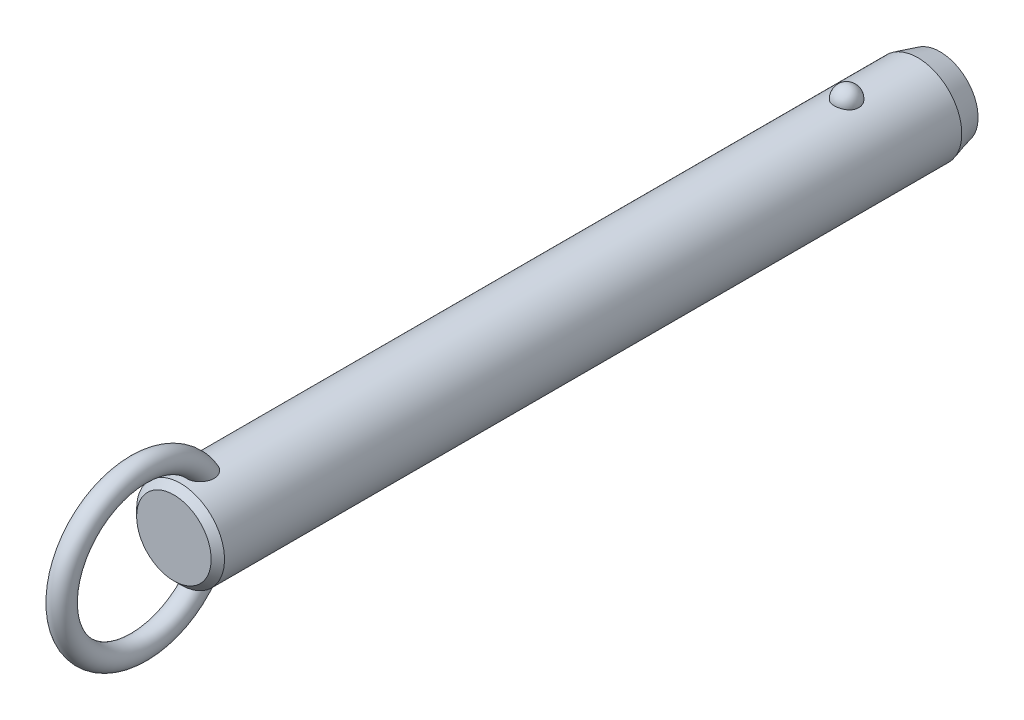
SolidWorks part; units mm, degrees
ref_plane "Front Plane" through (0, 0, 0) normal (0, 0, 1) x (1, 0, 0)
ref_plane "Top Plane" through (0, 0, 0) normal (0, 1, 0) x (1, 0, 0)
ref_plane "Right Plane" through (0, 0, 0) normal (1, 0, 0) x (0, 0, -1)
sketch "Sketch2" plane through (0, 0, 0) normal (0, 0, 1) x (1, 0, 0)
  circle A0 centre (0, 0) radius 7.9
  point P3 (0, 7.9)
  dimension "D1" = 15.8
extrude "Boss-Extrude1" add sketch "Sketch2" along normal blind 109.2
sketch "Sketch3" plane through (0, 0, 0) normal (0, 0, -1) x (-1, 0, 0)
  circle A0 centre (0, 0) radius 7.9
  dimension "D1" = 15.8
extrude "Boss-Extrude2" add sketch "Sketch3" along normal blind 19
chamfer "Chamfer1" distance 4 angle 15 1 edges at (-7.9, 0, -19)
sketch "Sketch12" plane through (0, 0, 0) normal (1, 0, 0) x (0, 0, -1)
  line L0 (-109.2, 7.9) -> (-109.2, -7.9) construction
  point P0 (-109.2, 0)
sketch "Sketch13" plane through (0, 0, 0) normal (1, 0, 0) x (0, 0, -1)
  circle A0 centre (-125.05, 0) radius 15.85
  point P2 (-109.2, 0)
  dimension "D1" = 31.7
sketch "Sketch14" plane through (0, 0, 0) normal (0, 1, 0) x (1, 0, 0)
  circle A0 centre (0, -111.2) radius 2
  point P2 (0, -109.2)
  dimension "D1" = 4
sweep "Sweep1" add profiles "Sketch14" path "Sketch13"
sketch "Sketch15" plane through (0, 0, 109.2) normal (0, 0, 1) x (1, 0, 0)
  circle A0 centre (0, 0) radius 7.9
  dimension "D1" = 15.8
extrude "Boss-Extrude3" add sketch "Sketch15" along normal blind 9.52
chamfer "Chamfer2" distance 1.2 angle 45 1 edges at (7.9, 0, 118.72)
sketch "Sketch18" plane through (0, 0, 0) normal (1, 0, 0) x (0, 0, -1)
  line L0 (15, 7.9) -> (-111.3091, 7.9) construction
  line L1 (2.2, 10.1) -> (2.2, 5.7)
  line L2 (-111.3091, -7.9) -> (15, -7.9) construction
  arc A0 (2.2, 10.1) -> (2.2, 5.7) centre (2.2, 7.9) ccw
  point P4 (0, 7.9)
  dimension "D1" = 18
revolve "Revolve1" add sketch "Sketch18" angle 360 about L1
